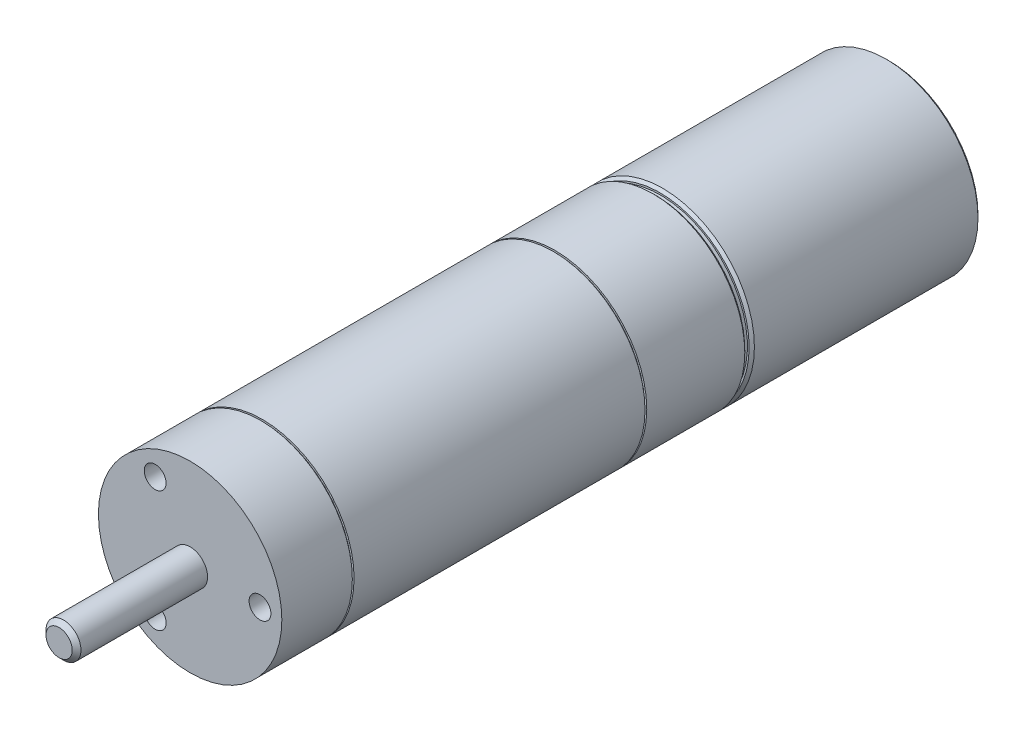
SolidWorks part; units mm, degrees
ref_plane "Plan de face" through (0, 0, 0) normal (0, 0, 1) x (1, 0, 0)
ref_plane "Plan de dessus" through (0, 0, 0) normal (0, 1, 0) x (1, 0, 0)
ref_plane "Plan de droite" through (0, 0, 0) normal (1, 0, 0) x (0, 0, -1)
sketch "Esquisse1" plane through (0, 0, 0) normal (0, 0, 1) x (1, 0, 0)
  circle A0 centre (0, 0) radius 10.5
  dimension "D1" = 21
extrude "Boss.-Extru.1" add sketch "Esquisse1" along normal blind 80
sketch "Esquisse2" plane through (0, 0, 80) normal (0, 0, 1) x (1, 0, 0)
  circle A0 centre (0, 0) radius 2
  dimension "D1" = 4
extrude "Boss.-Extru.2" add sketch "Esquisse2" along normal blind 15
chamfer "Chanfrein1" distance 0.5 angle 45 1 edges at (2, 0, 95)
sketch "Esquisse3" plane through (0, 0, 80) normal (0, 0, 1) x (1, 0, 0)
  line L0 (-13.9465, 0) -> (16.1451, 0) construction
  line L1 (-4, 6.9282) -> (0, 0) construction
  circle A0 centre (-4, 6.9282) radius 1.25
  circle A1 centre (8, 0) radius 1.25
  circle A2 centre (-4, -6.9282) radius 1.25
  dimension "D1" = 2.5
  dimension "D2" = 60
  dimension "D3" = 8
  dimension "D4" = 3
extrude "Enlèv. mat.-Extru.1" cut sketch "Esquisse3" against normal blind 5
sketch "Esquisse4" plane through (0, 0, 0) normal (0, 1, 0) x (1, 0, 0)
  line L0 (0, 6.6411) -> (0, -98.2739) construction
  line L1 (10.5, -80) -> (10.5, 0) construction
  line L2 (11.5069, -71.7284) -> (10.2762, -71.7284)
  line L3 (11.5069, -71.7284) -> (11.5069, -71.9284)
  line L4 (11.5069, -71.9284) -> (10.2762, -71.9284)
  line L5 (10.2762, -71.7284) -> (10.2762, -71.9284)
  line L6 (10.2762, -38.4215) -> (11.5069, -38.4215)
  line L7 (10.2762, -38.4215) -> (10.2762, -38.2215)
  line L8 (10.2762, -38.2215) -> (11.5069, -38.2215)
  line L9 (11.5069, -38.4215) -> (11.5069, -38.2215)
  line L10 (10, -26.1978) -> (10.6153, -26.1978)
  line L11 (10, -26.1978) -> (10, -26.6978)
  line L12 (10, -26.6978) -> (10.6153, -26.6978)
  line L13 (10.6153, -26.1978) -> (10.6153, -26.6978)
  dimension "D1" = 0.2
  dimension "D2" = 0.2
  dimension "D3" = 0.5
  dimension "D4" = 0.5
revolve "Enlèvement de matière-Révolution1" cut sketch "Esquisse4" angle 360 about L0
chamfer "Chanfrein2" distance 0.3 angle 45 3 edges at (10.5, 0, 26.1978) (10.5, 0, 0) (-10.5, 0, 26.6978)
